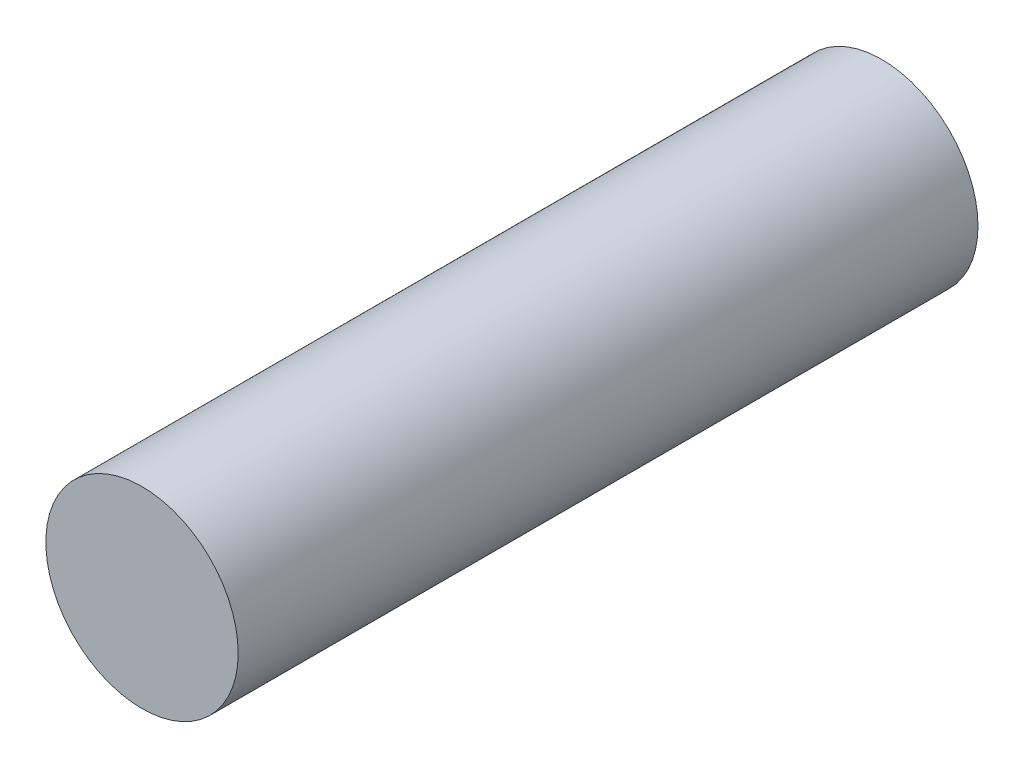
SolidWorks part; units mm, degrees
ref_plane "Płaszczyzna przednia" through (0, 0, 0) normal (0, 0, 1) x (1, 0, 0)
ref_plane "Płaszczyzna górna" through (0, 0, 0) normal (0, 1, 0) x (1, 0, 0)
ref_plane "Płaszczyzna prawa" through (0, 0, 0) normal (1, 0, 0) x (0, 0, -1)
sketch "Szkic1" plane through (0, 0, 0) normal (0, 0, 1) x (1, 0, 0)
  circle A0 centre (0, 0) radius 13
  dimension "D1" = 26
extrude "Dodanie-wyciągnięcie1" add sketch "Szkic1" along normal blind 100
